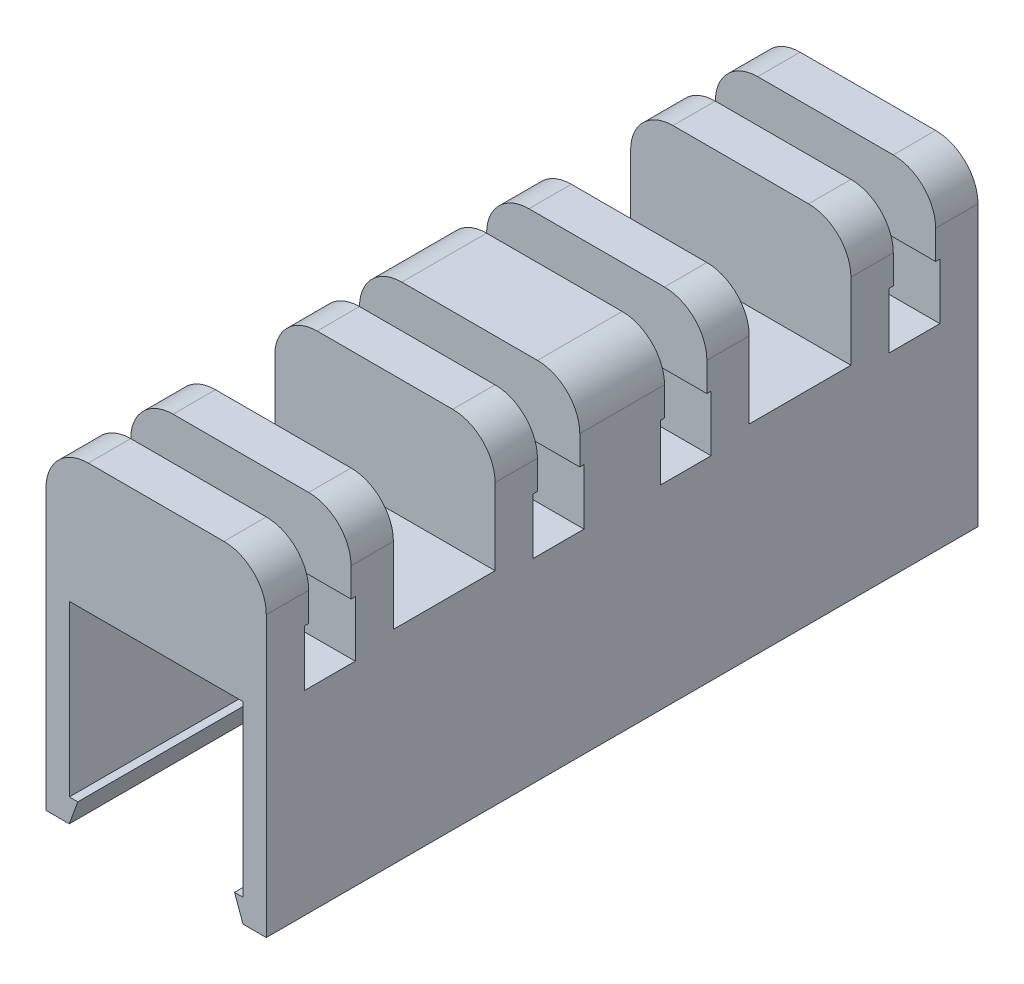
SolidWorks part; units mm, degrees
ref_plane "Plan de face" through (0, 0, 0) normal (0, 0, 1) x (1, 0, 0)
ref_plane "Plan de dessus" through (0, 0, 0) normal (0, 1, 0) x (1, 0, 0)
ref_plane "Plan de droite" through (0, 0, 0) normal (1, 0, 0) x (0, 0, -1)
sketch "Esquisse1" plane through (0, 0, 0) normal (0, 0, 1) x (1, 0, 0)
  line B0 (-13, -22.75) -> (-13, 10.25)
  line B1 (13, -22.75) -> (13, 10.25)
  line B2 (-10.25, -20) -> (-10.25, 0)
  line B3 (10.25, -20) -> (10.25, 0)
  line B4 (-9.25, -20) -> (-10.25, -22.75)
  line B5 (9.25, -20) -> (10.25, -22.75)
  line B6 (13, -22.75) -> (10.25, -22.75)
  line B7 (-10.25, -22.75) -> (-13, -22.75)
  line B8 (-9.25, -20) -> (-10.25, -20)
  line B9 (10.25, -20) -> (9.25, -20)
  line B10 (-8, 15.25) -> (8, 15.25)
  line B11 (10.25, 0) -> (-10.25, 0)
  arc B12 (13, 10.25) -> (8, 15.25) centre (8, 10.25) ccw
  arc B13 (-8, 15.25) -> (-13, 10.25) centre (-8, 10.25) ccw
sketch_block_instance "Bloc1-1"
sketch_block "Bloc1"
extrude "Extrusion1" add sketch "Esquisse1" along normal blind 84
sketch "Esquisse2" plane through (13, 0, 0) normal (1, 0, 0) x (0, 0, -1)
  line B0 (-69, 1.25) -> (-57, 1.25)
  line B1 (-84, 15.25) -> (-84, 22.2006)
  line B2 (-84, 22.2006) -> (0, 22.2006)
  line B3 (0, 22.2006) -> (0, 15.25)
  line B4 (-69, 15.25) -> (-74, 15.25)
  line B5 (-79, 15.25) -> (-84, 15.25)
  line B6 (-73.5, 6.8534) -> (-73.5, 0.25)
  line B7 (-79.5, 6.8534) -> (-79.5, 0.25)
  line B8 (-79.5, 0.25) -> (-73.5, 0.25)
  line B9 (-74, 6.8534) -> (-73.5, 6.8534)
  line B10 (-79.5, 6.8534) -> (-79, 6.8534)
  line B11 (-69, 15.25) -> (-69, 1.25)
  line B12 (-74, 15.25) -> (-74, 6.8534)
  line B13 (-79, 15.25) -> (-79, 6.8534)
  line B14 (-37, 15.25) -> (-47, 15.25)
  line B15 (-27, 15.25) -> (-32, 15.25)
  line B16 (-10, 15.25) -> (-15, 15.25)
  line B17 (0, 15.25) -> (-5, 15.25)
  line B18 (-52, 15.25) -> (-57, 15.25)
  line B19 (-37.5, 6.8534) -> (-37.5, 0.25)
  line B20 (-31.5, 6.8534) -> (-31.5, 0.25)
  line B21 (-10.5, 6.8534) -> (-10.5, 0.25)
  line B22 (-4.5, 6.8534) -> (-4.5, 0.25)
  line B23 (-37.5, 0.25) -> (-31.5, 0.25)
  line B24 (-27, 1.25) -> (-15, 1.25)
  line B25 (-10.5, 0.25) -> (-4.5, 0.25)
  line B26 (-37.5, 6.8534) -> (-37, 6.8534)
  line B27 (-32, 6.8534) -> (-31.5, 6.8534)
  line B28 (-10.5, 6.8534) -> (-10, 6.8534)
  line B29 (-5, 6.8534) -> (-4.5, 6.8534)
  line B30 (-52.5, 6.8534) -> (-52.5, 0.25)
  line B31 (-46.5, 6.8534) -> (-46.5, 0.25)
  line B32 (-52.5, 0.25) -> (-46.5, 0.25)
  line B33 (-52.5, 6.8534) -> (-52, 6.8534)
  line B34 (-47, 6.8534) -> (-46.5, 6.8534)
  line B35 (-27, 15.25) -> (-27, 1.25)
  line B36 (-15, 15.25) -> (-15, 1.25)
  line B37 (-37, 15.25) -> (-37, 6.8534)
  line B38 (-32, 15.25) -> (-32, 6.8534)
  line B39 (-10, 15.25) -> (-10, 6.8534)
  line B40 (-5, 15.25) -> (-5, 6.8534)
  line B41 (-57, 15.25) -> (-57, 1.25)
  line B42 (-52, 15.25) -> (-52, 6.8534)
  line B43 (-47, 15.25) -> (-47, 6.8534)
sketch_block_instance "Bloc2-1"
sketch_block "Bloc2"
extrude "Enlèv. mat.-Extru.1" cut sketch "Esquisse2" against normal through all
sketch "Esquisse3" [suppressed] plane through (26, 0, 0) normal (1, 0, 0) x (0, 0, -1)
  line L0 (0, 0) -> (0, 33) construction
  line L1 (-84, 0) -> (-84, 33) construction
  line L3 (0, 0) -> (0, 33)
  line L4 (-84, 0) -> (-84, 33)
  line L5 (0, 33) -> (0, 38) construction
  line L7 (-84, 38) -> (-84, 33) construction
  line L8 (0, 33) -> (0, 38)
  line L9 (-84, 38) -> (-84, 33)
  line L10 (-84, 38) -> (-66, 38)
  line L11 (-66, 38) -> (-66, 0)
  line L12 (-84, 0) -> (0, 0) construction
  line L13 (-66, 0) -> (-84, 0)
  line L14 (0, 38) -> (-18, 38)
  line L15 (-18, 38) -> (-18, 0)
  line L16 (-18, 0) -> (0, 0)
  dimension "D1" = 48
extrude "Enlèv. mat.-Extru.2" [suppressed] cut sketch "Esquisse3" against normal through all
